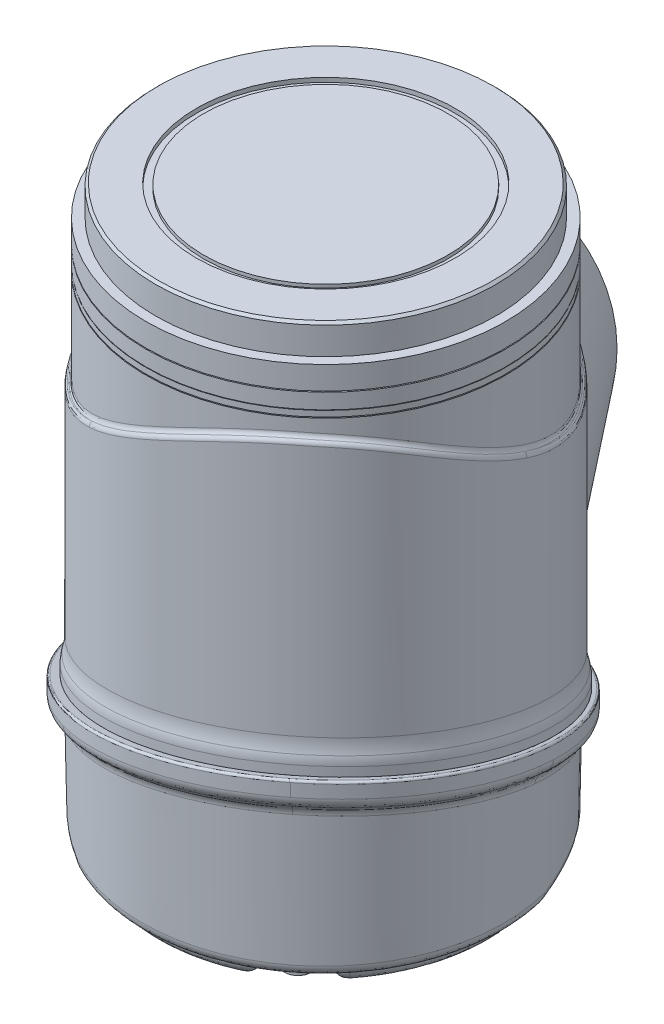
SolidWorks part; units mm, degrees
other "shell_2"
other "shell_3"
other "1"
other "shell_1"
other "2"
other "brep_2"
ref_plane "前视基准面" through (0, 0, 0) normal (0, 0, 1) x (1, 0, 0)
ref_plane "上视基准面" through (0, 0, 0) normal (0, 1, 0) x (1, 0, 0)
ref_plane "右视基准面" through (0, 0, 0) normal (1, 0, 0) x (0, 0, -1)
imported_body "输入1"
imported_body "输入2"
imported_body "曲面-输入1"
imported_body "输入3"
imported_body "曲面-输入2"
imported_body "曲面-输入3"
imported_body "输入4"
imported_body "输入5"
move or copy body "实体-移动/复制1" bodies to move or copy 111 copy no translate (0, -0.2, 0)
